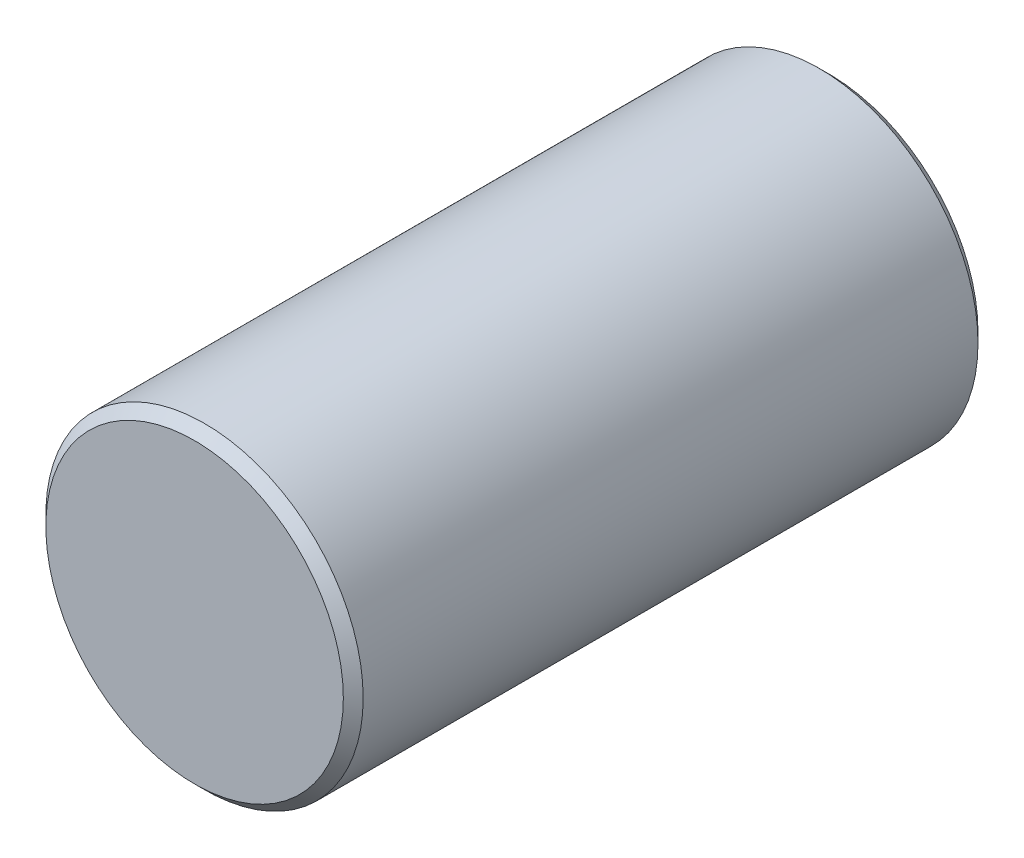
SolidWorks part; units mm, degrees
ref_plane "Front Plane" through (0, 0, 0) normal (0, 0, 1) x (1, 0, 0)
ref_plane "Top Plane" through (0, 0, 0) normal (0, 1, 0) x (1, 0, 0)
ref_plane "Right Plane" through (0, 0, 0) normal (1, 0, 0) x (0, 0, -1)
sketch "Sketch1" plane through (0, 0, 0) normal (1, 0, 0) x (0, 0, -1)
  line L0 (10.6747, 0) -> (50010.6747, 0) construction
  line L1 (0, 0) -> (16, 0)
  line L6 (0.25, 4) -> (0, 3.75)
  line L7 (0, 3.75) -> (0, 0)
  line L8 (15.75, 4) -> (0.25, 4)
  line L9 (16, 3.75) -> (15.75, 4)
  line L10 (16, 0) -> (16, 3.75)
  dimension "D1" = 45
  dimension "D2" = 45
  dimension "D3" = 16
  dimension "D4" = 0.25
  dimension "D5" = 8
revolve "Revolve1" add sketch "Sketch1" angle 360 about L0
